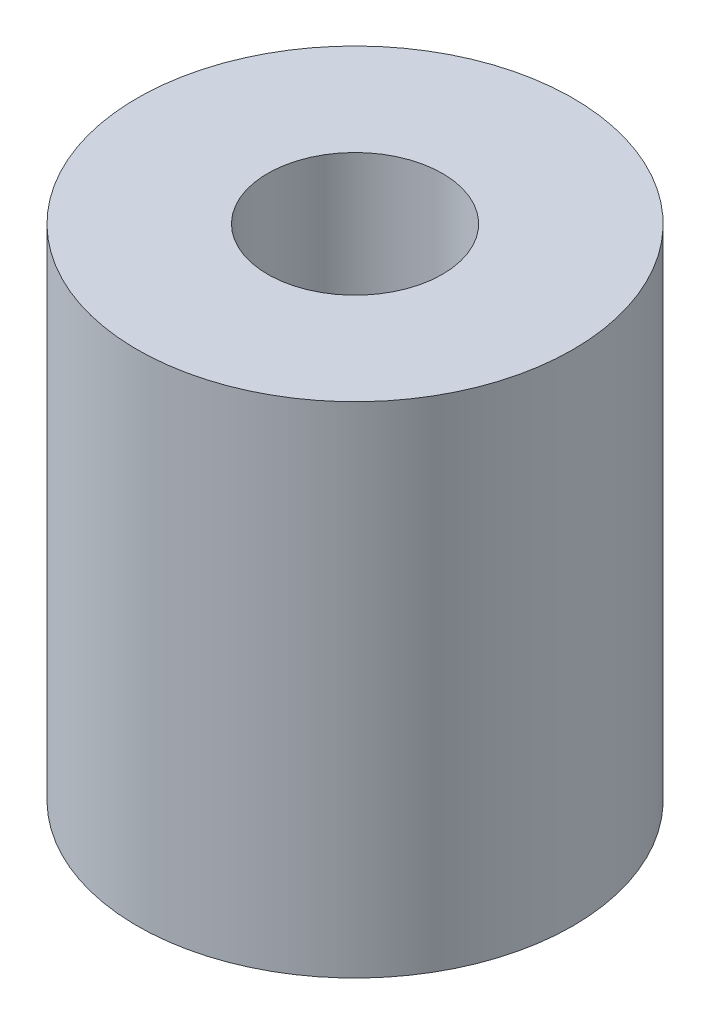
SolidWorks part; units mm, degrees
ref_plane "Plan de face" through (0, 0, 0) normal (0, 0, 1) x (1, 0, 0)
ref_plane "Plan de dessus" through (0, 0, 0) normal (0, 1, 0) x (1, 0, 0)
ref_plane "Plan de droite" through (0, 0, 0) normal (1, 0, 0) x (0, 0, -1)
sketch "Esquisse1" plane through (0, 0, 0) normal (0, 0, 1) x (1, 0, 0)
  line L0 (7.9, 9.05) -> (3.17, 9.05)
  line L1 (3.17, 9.05) -> (3.17, -9.05)
  line L2 (3.17, -9.05) -> (7.9, -9.05)
  line L3 (7.9, -9.05) -> (7.9, 9.05)
  line L4 (0, 9.05) -> (0, -9.05) construction
revolve "Révolution1" add sketch "Esquisse1" angle 360 about L4
